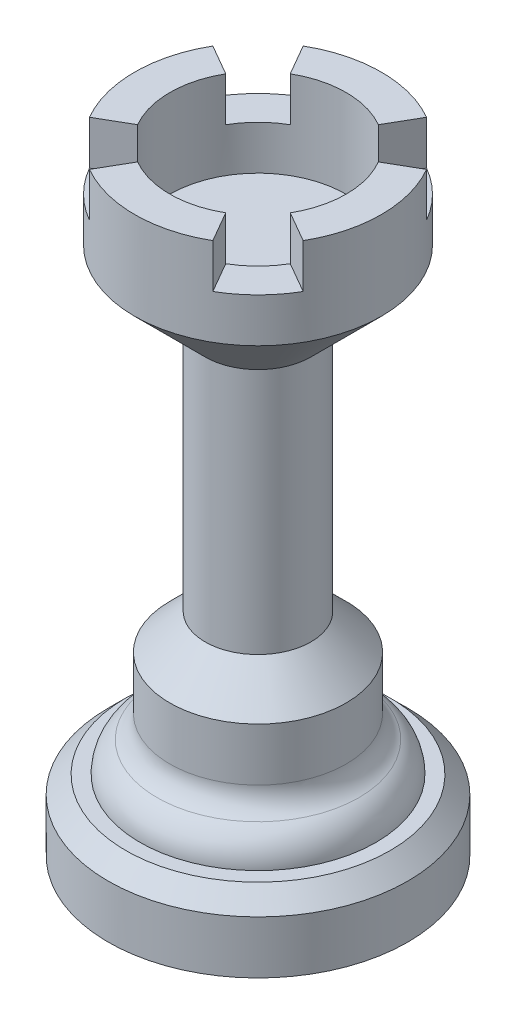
SolidWorks part; units mm, degrees
ref_plane "Alzado" through (0, 0, 0) normal (0, 0, 1) x (1, 0, 0)
ref_plane "Planta" through (0, 0, 0) normal (0, 1, 0) x (1, 0, 0)
ref_plane "Vista lateral" through (0, 0, 0) normal (1, 0, 0) x (0, 0, -1)
sketch "Croquis1" plane through (0, 0, 0) normal (0, 0, 1) x (1, 0, 0)
  line L0 (0, -173.6019) -> (0, 8506.492) construction
  line L1 (0, 0) -> (17, 0)
  line L2 (17, 8) -> (13.3944, 8)
  line L3 (6, 24) -> (6, 52)
  line L4 (14, 60) -> (14, 70)
  line L5 (14, 70) -> (10, 70)
  line L6 (10, 70) -> (10, 60)
  line L7 (10, 60) -> (0, 60)
  line L8 (0, 60) -> (0, 0)
  line L9 (17, 8) -> (17, 0)
  line L10 (6, 52) -> (14, 60)
  line L11 (10, 14) -> (10, 20)
  line L12 (10, 20) -> (6, 24)
  arc A2 (13.3944, 8) -> (11.4548, 11.4286) centre (9.3944, 8) ccw
  arc A3 (11.4548, 11.4286) -> (10, 14) centre (13, 14) cw
  point P5 (0, 0)
  dimension "D1" = 70
  dimension "D2" = 10
  dimension "D4" = 4
  dimension "D5" = 20
  dimension "D7" = 28
  dimension "D12" = 12
  dimension "D13" = 3
  dimension "D14" = 20
  dimension "D3" = 8
  dimension "D10" = 52
  dimension "D11" = 14
  dimension "D6" = 45
  dimension "D8" = 4
  dimension "D16" = 34
revolve "Revolución1" add sketch "Croquis1" angle 360 about L0
sketch "Croquis2" plane through (0, 70, 0) normal (0, 1, 0) x (1, 0, 0)
  line L0 (8.6603, 5) -> (12.1244, 7)
  line L1 (5, 8.6603) -> (7, 12.1244)
  line L2 (9.8995, 9.8995) -> (0, 0) construction
  line L3 (0, 0) -> (14, 0) construction
  circle A1 centre (0, 0) radius 10 construction
  circle A2 centre (0, 0) radius 14 construction
  arc A3 (12.1244, 7) -> (7, 12.1244) centre (0, 0) ccw
  circle A5 centre (0, 0) radius 10 construction
  arc A6 (10, 0) -> (5, 8.6603) centre (0, 0) ccw
  point P3 (0, 0)
  point P11 (9.0169, 4.3239)
  point P12 (12.4452, 6.4122)
  point P15 (0, 0)
  dimension "D1" = 30
  dimension "D2" = 45
extrude "Cortar-Extruir1" cut sketch "Croquis2" against normal blind 5 contours L1 L0 M3 M4
ref_axis "Eje1" through (0, 79.4437, 0) along (0, -1, 0)
pattern_circular "MatrizC1" count 4 over 360 about axis through (0, 79.4437, 0) along (0, -1, 0) of "Cortar-Extruir1"
chamfer "Chaflán1" distance 2 angle 45 1 edges at (17, 8, 0)
